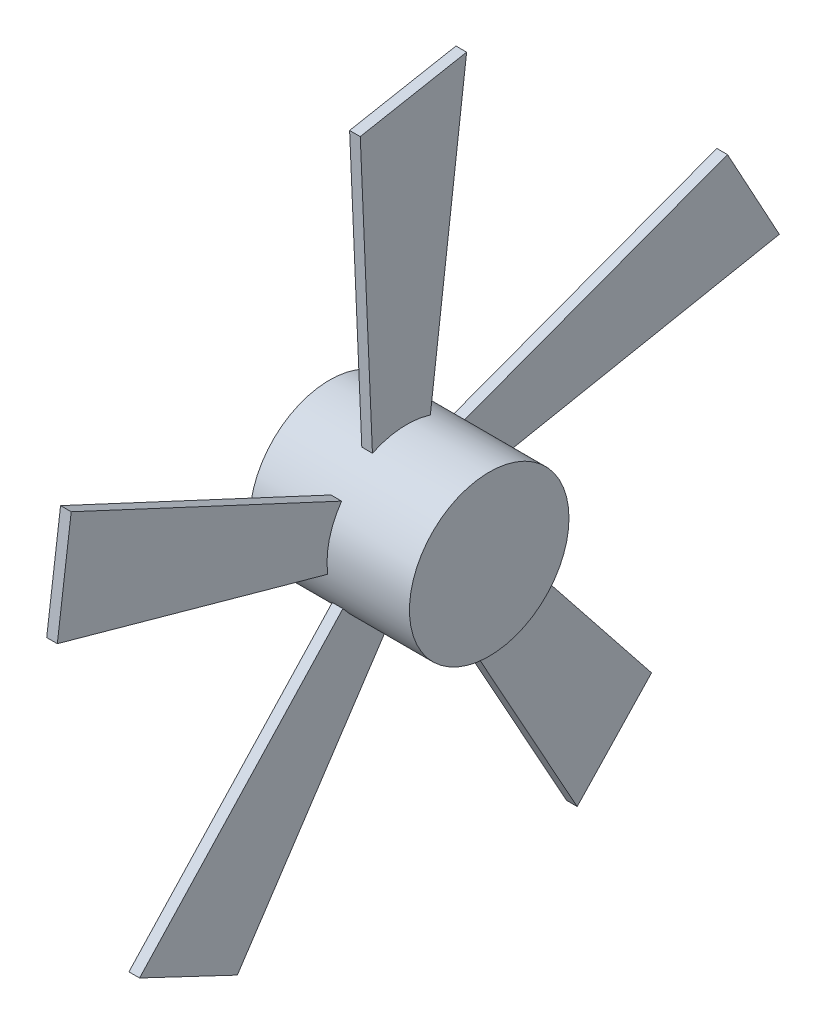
SolidWorks part; units mm, degrees
ref_plane "Front Plane" through (0, 0, 0) normal (1, 0, 0) x (0, 1, 0)
ref_plane "Top Plane" through (0, 0, 0) normal (0, 0, 1) x (0, 1, 0)
ref_plane "Right Plane" through (0, 0, 0) normal (0, 1, 0) x (-1, 0, 0)
sketch "Sketch1" plane through (0, 0, 0) normal (1, 0, 0) x (0, 1, 0)
  circle A0 centre (0, 0) radius 15.24
extrude "Circular_section" add sketch "Sketch1" along normal blind 30.48
ref_plane "Plane1" through (12.7, 0, 0) normal (1, 0, 0) x (0, 1, 0)
sketch "Sketch2" plane through (12.7, 0, 0) normal (1, 0, 0) x (0, 1, 0)
  line L0 (8.89, -3.81) -> (71.12, -11.43)
  line L1 (71.12, -11.43) -> (67.31, 8.89)
  line L2 (67.31, 8.89) -> (8.89, 6.35)
  line L3 (8.89, 6.35) -> (8.89, -3.81)
extrude "Blade_1" add sketch "Sketch2" along normal blind 2.032
ref_plane "Plane2" through (12.7, 0, 0) normal (1, 0, 0) x (0, 1, 0)
sketch "Sketch3" plane through (12.7, 0, 0) normal (1, 0, 0) x (0, 1, 0)
  line L0 (6.3707, 7.2775) -> (32.8479, 64.1071)
  line L1 (32.8479, 64.1071) -> (12.345, 66.7628)
  line L2 (12.345, 66.7628) -> (-3.292, 10.4172)
  line L3 (-3.292, 10.4172) -> (6.3707, 7.2775)
extrude "Blade_2" add sketch "Sketch3" along normal blind 2.032
ref_plane "Plane3" through (12.7, 0, 0) normal (1, 0, 0) x (0, 1, 0)
sketch "Sketch4" plane through (12.7, 0, 0) normal (1, 0, 0) x (0, 1, 0)
  line L0 (-4.9527, 8.3078) -> (-50.8189, 51.0504)
  line L1 (-50.8189, 51.0504) -> (-59.6803, 32.3717)
  line L2 (-59.6803, 32.3717) -> (-10.9246, 0.0882)
  line L3 (-10.9246, 0.0882) -> (-4.9527, 8.3078)
extrude "Blade_3" add sketch "Sketch4" along normal blind 2.032
ref_plane "Plane4" through (12.7, 0, 0) normal (1, 0, 0) x (0, 1, 0)
sketch "Sketch5" plane through (12.7, 0, 0) normal (1, 0, 0) x (0, 1, 0)
  line L0 (-9.4316, -2.1431) -> (-64.2557, -32.5562)
  line L1 (-64.2557, -32.5562) -> (-49.2295, -46.756)
  line L2 (-49.2295, -46.756) -> (-3.4597, -10.3627)
  line L3 (-3.4597, -10.3627) -> (-9.4316, -2.1431)
extrude "Blade_4" add sketch "Sketch5" along normal blind 2.032
ref_plane "Plane5" through (12.7, 0, 0) normal (1, 0, 0) x (0, 1, 0)
sketch "Sketch6" plane through (12.7, 0, 0) normal (1, 0, 0) x (0, 1, 0)
  line L0 (-0.8764, -9.6322) -> (11.1067, -71.1712)
  line L1 (11.1067, -71.1712) -> (29.2548, -61.2685)
  line L2 (29.2548, -61.2685) -> (8.7864, -6.4926)
  line L3 (8.7864, -6.4926) -> (-0.8764, -9.6322)
extrude "Blade_5" add sketch "Sketch6" along normal blind 2.032
